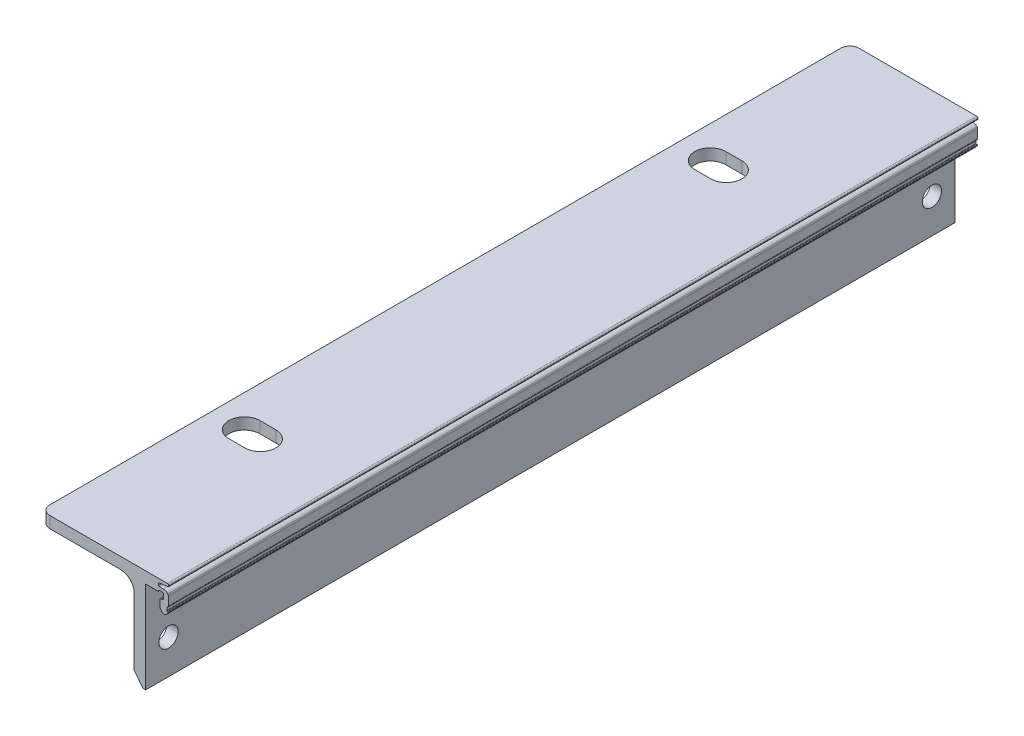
SolidWorks part; units mm, degrees
ref_plane "前视基准面" through (0, 0, 0) normal (0, 0, 1) x (1, 0, 0)
ref_plane "上视基准面" through (0, 0, 0) normal (0, 1, 0) x (1, 0, 0)
ref_plane "右视基准面" through (0, 0, 0) normal (1, 0, 0) x (0, 0, -1)
sketch "草图1" plane through (0, 0, 0) normal (0, 0, 1) x (1, 0, 0)
  line L0 (2329.984, -3290.1038) -> (2355.384, -3290.1038)
  line L1 (2329.984, -3292.6038) -> (2350.384, -3292.6038)
  line L2 (2352.884, -3292.6038) -> (2355.384, -3292.6038)
  line L3 (2350.384, -3292.6038) -> (2350.384, -3310.1038)
  line L4 (2352.884, -3292.6038) -> (2352.884, -3312.6038)
  line L5 (2355.384, -3292.6038) -> (2355.384, -3290.1038) construction
  line L6 (2355.384, -3290.1038) -> (2357.924, -3290.1038) construction
  line L8 (2329.984, -3290.1038) -> (2329.984, -3292.6038)
  line L10 (2352.884, -3312.6038) -> (2352.284, -3312.6038)
  line L11 (2350.384, -3310.1038) -> (2352.284, -3312.6038)
  line L12 (2356.524, -3292.3038) -> (2355.988, -3292.3038)
  line L13 (2357.5972, -3295.408) -> (2357.724, -3295.408)
  line L14 (2357.624, -3290.1038) -> (2357.924, -3290.1038) construction
  line L15 (2357.8006, -3295.5917) -> (2357.3831, -3296.0891)
  line L16 (2357.4972, -3294.808) -> (2357.4972, -3295.308)
  line L17 (2357.824, -3295.508) -> (2357.824, -3295.5274)
  line L18 (2357.824, -3292.376) -> (2357.824, -3294.2738)
  line L19 (2356.324, -3293.7038) -> (2356.524, -3293.7038)
  line L20 (2356.024, -3295.4545) -> (2356.024, -3294.0038)
  line L21 (2357.7449, -3290.6914) -> (2355.9031, -3290.8849)
  line L22 (2355.724, -3291.0839) -> (2355.724, -3291.4038)
  line L23 (2355.924, -3291.6038) -> (2356.77, -3291.6038)
  line L24 (2357.924, -3290.4038) -> (2357.924, -3290.4925)
  line L25 (2356.465, -3296.0891) -> (2356.0943, -3295.6474)
  line L26 (2356.824, -3293.4038) -> (2356.824, -3292.6038)
  line L27 (2357.924, -3290.4038) -> (2357.924, -3290.1038) construction
  line L28 (2355.384, -3292.6038) -> (2355.4683, -3292.6038)
  line L29 (2355.384, -3290.1038) -> (2357.624, -3290.1038)
  arc A0 (2357.4972, -3294.808) -> (2357.6606, -3294.5409) centre (2357.7972, -3294.808) cw
  arc A1 (2356.77, -3291.6038) -> (2357.7198, -3292.0704) centre (2356.77, -3292.8038) cw
  arc A2 (2357.824, -3295.5274) -> (2357.8006, -3295.5917) centre (2357.724, -3295.5274) cw
  arc A3 (2355.724, -3291.0839) -> (2355.9031, -3290.8849) centre (2355.924, -3291.0839) cw
  arc A4 (2357.924, -3290.4925) -> (2357.7449, -3290.6914) centre (2357.724, -3290.4925) cw
  arc A5 (2355.7282, -3292.4538) -> (2355.4683, -3292.6038) centre (2355.4683, -3292.3038) cw
  arc A6 (2357.624, -3290.1038) -> (2357.924, -3290.4038) centre (2357.624, -3290.4038) cw
  arc A7 (2357.5972, -3295.408) -> (2357.4972, -3295.308) centre (2357.5972, -3295.308) cw
  arc A8 (2357.824, -3294.2738) -> (2357.6606, -3294.5409) centre (2357.524, -3294.2738) cw
  arc A9 (2355.924, -3291.6038) -> (2355.724, -3291.4038) centre (2355.924, -3291.4038) cw
  arc A10 (2356.524, -3292.3038) -> (2356.824, -3292.6038) centre (2356.524, -3292.6038) cw
  arc A11 (2356.0943, -3295.6474) -> (2356.024, -3295.4545) centre (2356.324, -3295.4545) cw
  arc A12 (2355.7282, -3292.4538) -> (2355.988, -3292.3038) centre (2355.988, -3292.6038) cw
  arc A13 (2357.7198, -3292.0704) -> (2357.824, -3292.376) centre (2357.324, -3292.376) cw
  arc A14 (2356.024, -3294.0038) -> (2356.324, -3293.7038) centre (2356.324, -3294.0038) cw
  arc A15 (2356.824, -3293.4038) -> (2356.524, -3293.7038) centre (2356.524, -3293.4038) cw
  arc A16 (2357.3831, -3296.0891) -> (2356.465, -3296.0891) centre (2356.924, -3295.7038) cw
  arc A17 (2357.724, -3295.408) -> (2357.824, -3295.508) centre (2357.724, -3295.508) cw
  dimension "D1" = 20
  dimension "D2" = 0.6
  dimension "D3" = 2.5
  dimension "D4" = 20.4
  dimension "D5" = 127.235
extrude "凸台-拉伸1" add sketch "草图1" along normal mid plane 176.45
fillet "圆角2" radius 3 1 edges at (2350.384, -3292.6038, 0)
sketch "草图2" plane through (0, -3290.1038, 0) normal (0, 1, 0) x (1, 0, 0)
  line L0 (2338.734, 54.2) -> (2338.734, 47.4) construction
  line L3 (2370.3278, 0) -> (2329.984, 0) construction
  line L5 (2329.984, -88.225) -> (2329.984, 88.225) construction
  line L6 (2340.484, -47.4) -> (2336.984, -47.4)
  line L7 (2340.484, -54.2) -> (2336.984, -54.2)
  line L9 (2340.484, 54.2) -> (2336.984, 54.2)
  line L10 (2340.484, 47.4) -> (2336.984, 47.4)
  arc A0 (2336.984, -54.2) -> (2336.984, -47.4) centre (2336.984, -50.8) cw
  arc A1 (2336.984, 54.2) -> (2336.984, 47.4) centre (2336.984, 50.8) ccw
  arc A2 (2340.484, -47.4) -> (2340.484, -54.2) centre (2340.484, -50.8) cw
  arc A4 (2340.484, 47.4) -> (2340.484, 54.2) centre (2340.484, 50.8) ccw
  dimension "D4" = 8.75
  dimension "D1" = 101.6
  dimension "D5" = 3.5
  dimension "D6" = 3.4
extrude "切除-拉伸1" cut sketch "草图2" against normal through all
sketch "草图3" plane through (2350.384, 0, 0) normal (-1, 0, 0) x (0, 0, 1)
  line L0 (-88.225, -3295.6038) -> (-88.225, -3310.1038) construction
  line L1 (88.225, -3290.1038) -> (-88.225, -3290.1038) construction
  line L2 (0, -3290.1038) -> (0, -3328.2905) construction
  circle A0 centre (-83.225, -3305.1038) radius 2.1
  circle A1 centre (83.225, -3305.1038) radius 2.1
  dimension "D1" = 4.2
  dimension "D2" = 5
  dimension "D3" = 15
extrude "切除-拉伸2" cut sketch "草图3" against normal through all
fillet "圆角1" radius 2 2 edges at (2329.984, -3291.3538, -88.225) (2329.984, -3291.3538, 88.225)
sketch "草图4" plane through (0, -3290.1038, 0) normal (0, 1, 0) x (1, 0, 0)
  line L0 (2329.984, 0) -> (2357.624, 0) construction
  line L1 (2329.984, -86.225) -> (2329.984, 86.225) construction
  line L3 (2357.624, -88.225) -> (2357.624, 88.225) construction
  circle A0 centre (2339.984, 124) radius 2.1
  circle A1 centre (2339.984, -124) radius 2.1
  dimension "D1" = 4.2
  dimension "D3" = 10
  dimension "D5" = 248
  dimension "D4" = 2
extrude "切除-拉伸5" [suppressed] cut sketch "草图4" against normal through all
chamfer "倒角1" [suppressed] distance 2 angle 45
